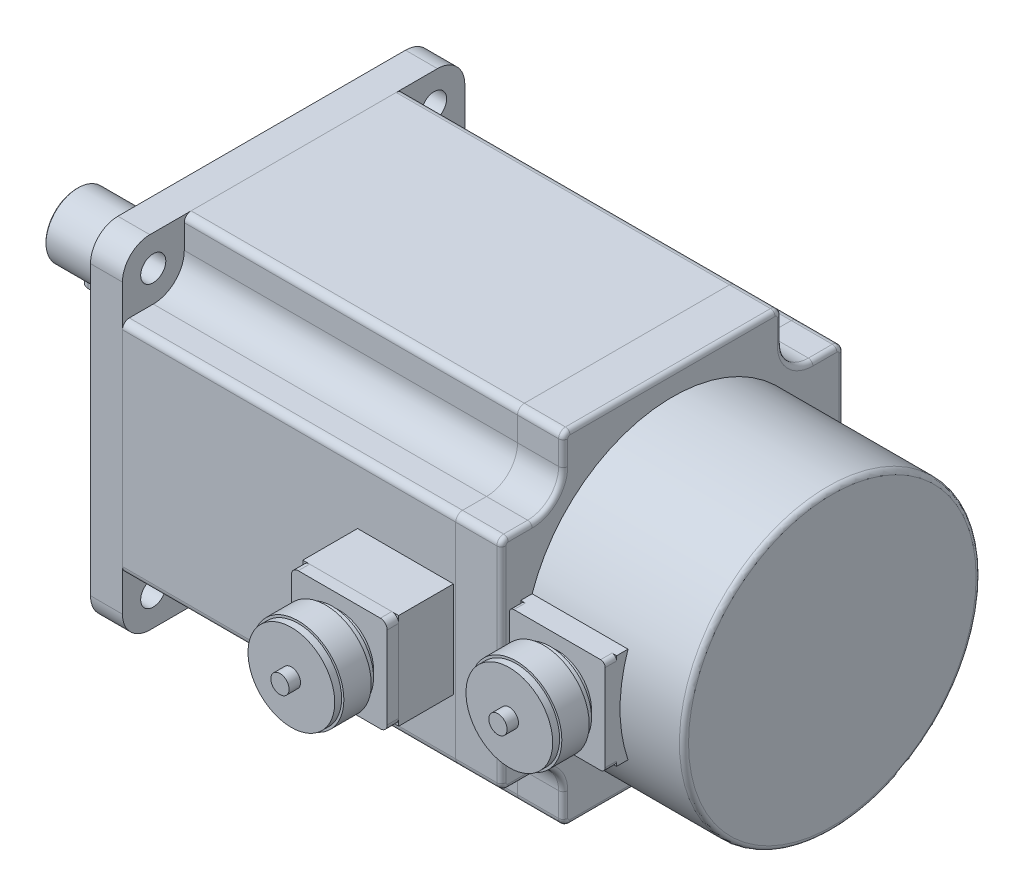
SolidWorks part; units mm, degrees
ref_plane "前视基准面" through (0, 0, 0) normal (0, 0, 1) x (1, 0, 0)
ref_plane "上视基准面" through (0, 0, 0) normal (0, 1, 0) x (1, 0, 0)
ref_plane "右视基准面" through (0, 0, 0) normal (1, 0, 0) x (0, 0, -1)
sketch "草图1" plane through (0, 0, 0) normal (1, 0, 0) x (0, 0, -1)
  line L1 (-63, -75) -> (63, -75)
  line L2 (-75, -63) -> (-75, 63)
  line L3 (-63, 75) -> (63, 75)
  line L4 (75, -63) -> (75, 63)
  line L5 (-75, -75) -> (75, 75) construction
  line L6 (-75, 75) -> (75, -75) construction
  arc A0 (63, -75) -> (75, -63) centre (63, -63) ccw
  arc A1 (-63, -75) -> (-75, -63) centre (-63, -63) cw
  arc A2 (-75, 63) -> (-63, 75) centre (-63, 63) cw
  arc A3 (63, 75) -> (75, 63) centre (63, 63) cw
  point P0 (0, 0)
  dimension "D1" = 12
extrude "凸台-拉伸1" add sketch "草图1" along normal blind 20
sketch "草图2" plane through (0, 0, 0) normal (-1, 0, 0) x (0, 0, 1)
  line L0 (-63, 75) -> (63, 75) construction
  line L1 (-63, -75) -> (63, -75)
  line L2 (-75, -63) -> (-75, 63)
  line L3 (-63, 75) -> (63, 75)
  line L4 (75, -63) -> (75, 63)
  line L5 (-75, -75) -> (75, 75) construction
  line L6 (-75, 75) -> (75, -75) construction
  arc A0 (63, 75) -> (75, 63) centre (63, 63) cw
  arc A1 (63, -75) -> (75, -63) centre (63, -63) ccw
  arc A2 (-63, -75) -> (-75, -63) centre (-63, -63) cw
  arc A3 (-75, 63) -> (-63, 75) centre (-63, 63) cw
  point P0 (0, 0)
  dimension "D1" = 12
extrude "凸台-拉伸2" add sketch "草图2" along normal blind 146 separate body
sketch "草图3" plane through (-146, 0, 0) normal (-1, 0, 0) x (0, 0, 1)
  line L0 (63, 75) -> (-63, 75) construction
  line L1 (-63, -75) -> (63, -75)
  line L2 (-75, -63) -> (-75, 63)
  line L3 (-63, 75) -> (63, 75)
  line L4 (75, -63) -> (75, 63)
  line L5 (-75, -75) -> (75, 75) construction
  line L6 (-75, 75) -> (75, -75) construction
  arc A0 (-63, -75) -> (-75, -63) centre (-63, -63) cw
  arc A1 (63, -75) -> (75, -63) centre (63, -63) ccw
  arc A2 (63, 75) -> (75, 63) centre (63, 63) cw
  arc A3 (-75, 63) -> (-63, 75) centre (-63, 63) cw
  point P0 (0, 0)
  dimension "D1" = 12
extrude "凸台-拉伸3" add sketch "草图3" along normal blind 14 separate body
sketch "草图4" plane through (0, 0, 75) normal (0, 0, 1) x (1, 0, 0)
  line L2 (-43, -21) -> (-1, -21)
  line L3 (-43, -21) -> (-43, 21)
  line L4 (-43, 21) -> (-1, 21)
  line L5 (-1, -21) -> (-1, 21)
  line L6 (-43, -21) -> (-1, 21) construction
  line L7 (-43, 21) -> (-1, -21) construction
extrude "凸台-拉伸4" add sketch "草图4" along normal blind 24 separate body
sketch "草图5" plane through (0, 0, 99) normal (0, 0, 1) x (1, 0, 0)
  line L0 (-1, 21) -> (-43, 21) construction
  line L1 (-40, -21) -> (-4, -21)
  line L2 (-43, -18) -> (-43, 18)
  line L3 (-40, 21) -> (-4, 21)
  line L4 (-1, -18) -> (-1, 18)
  line L5 (-43, -21) -> (-1, 21) construction
  line L6 (-43, 21) -> (-1, -21) construction
  arc A0 (-40, -21) -> (-43, -18) centre (-40, -18) cw
  arc A1 (-4, -21) -> (-1, -18) centre (-4, -18) ccw
  arc A2 (-4, 21) -> (-1, 18) centre (-4, 18) cw
  arc A3 (-43, 18) -> (-40, 21) centre (-40, 18) cw
  point P0 (-22, 0)
  dimension "D1" = 3
extrude "凸台-拉伸5" add sketch "草图5" along normal blind 5 separate body
sketch "草图6" plane through (0, 0, 104) normal (0, 0, 1) x (1, 0, 0)
  circle A0 centre (-22, 0) radius 15
extrude "凸台-拉伸6" add sketch "草图6" along normal blind 3 separate body
sketch "草图7" plane through (0, 0, 107) normal (0, 0, 1) x (1, 0, 0)
  circle A0 centre (-22, 0) radius 18
extrude "凸台-拉伸7" add sketch "草图7" along normal blind 3 separate body
sketch "草图8" plane through (0, 0, 110) normal (0, 0, 1) x (1, 0, 0)
  circle A0 centre (-22, 0) radius 20
extrude "凸台-拉伸8" add sketch "草图8" along normal blind 12 separate body
sketch "草图9" plane through (0, 0, 122) normal (0, 0, 1) x (1, 0, 0)
  circle A0 centre (-22, 0) radius 19
extrude "凸台-拉伸9" add sketch "草图9" along normal blind 3
sketch "草图10" plane through (0, 0, 125) normal (0, 0, 1) x (1, 0, 0)
  circle A0 centre (-22, 0) radius 4
extrude "凸台-拉伸10" add sketch "草图10" along normal blind 5
sketch "草图11" plane through (20, 0, 0) normal (1, 0, 0) x (0, 0, -1)
  line L0 (47.9169, -61.5) -> (47.9169, -72)
  line L1 (-75, -44.9169) -> (-75, -63)
  line L2 (-63, -75) -> (-44.9169, -75)
  line L3 (44.9169, -75) -> (63, -75)
  line L4 (75, -63) -> (75, -44.9169)
  line L6 (75, 63) -> (75, 44.9169)
  line L7 (-63, -75) -> (63, -75) construction
  line L8 (63, 75) -> (44.9169, 75)
  line L9 (-47.9169, -72) -> (-47.9169, -61.5)
  line L10 (-44.9169, 75) -> (-63, 75)
  line L11 (-61.5, -47.9169) -> (-72, -47.9169)
  line L12 (75, -63) -> (75, 63) construction
  line L13 (-75, 63) -> (-75, 44.9169)
  line L14 (-72, 47.9169) -> (-61.5, 47.9169)
  line L16 (-47.9169, 61.5) -> (-47.9169, 72)
  line L17 (63, 75) -> (-63, 75) construction
  line L19 (47.9169, 72) -> (47.9169, 61.5)
  line L21 (61.5, 47.9169) -> (72, 47.9169)
  line L22 (-75, 63) -> (-75, -63) construction
  line L24 (72, -47.9169) -> (61.5, -47.9169)
  arc A0 (-61.5, 47.9169) -> (-47.9169, 61.5) centre (-61.5, 61.5) ccw
  arc A1 (47.9169, 61.5) -> (61.5, 47.9169) centre (61.5, 61.5) ccw
  arc A2 (-47.9169, -61.5) -> (-61.5, -47.9169) centre (-61.5, -61.5) ccw
  arc A3 (-72, -47.9169) -> (-75, -44.9169) centre (-72, -44.9169) cw
  arc A4 (61.5, -47.9169) -> (47.9169, -61.5) centre (61.5, -61.5) ccw
  arc A5 (-75, 44.9169) -> (-72, 47.9169) centre (-72, 44.9169) cw
  arc A6 (-47.9169, 72) -> (-44.9169, 75) centre (-44.9169, 72) cw
  arc A7 (44.9169, 75) -> (47.9169, 72) centre (44.9169, 72) cw
  arc A8 (72, 47.9169) -> (75, 44.9169) centre (72, 44.9169) cw
  arc A9 (75, -44.9169) -> (72, -47.9169) centre (72, -44.9169) cw
  arc A10 (47.9169, -72) -> (44.9169, -75) centre (44.9169, -72) cw
  arc A11 (-44.9169, -75) -> (-47.9169, -72) centre (-44.9169, -72) cw
  arc A12 (-63, 75) -> (-75, 63) centre (-63, 63) ccw
  arc A13 (75, 63) -> (63, 75) centre (63, 63) ccw
  arc A14 (63, -75) -> (75, -63) centre (63, -63) ccw
  arc A15 (-75, -63) -> (-63, -75) centre (-63, -63) ccw
  point P0 (0, 0)
  point P1 (0, 0)
  point P12 (-75, -47.9169)
  point P43 (-75, 47.9169)
  point P47 (-47.9169, 75)
  point P48 (51.9891, -75)
  point P52 (47.9169, 75)
  point P56 (75, 47.9169)
  point P65 (75, -47.9169)
  point P82 (-47.9169, -75)
  dimension "D1" = 3
extrude "切除-拉伸2" cut sketch "草图11" against normal blind 166
fillet "圆角1" radius 2 24 edges at (20, 75, 0) (20, 0, -75) (20, -75, 0) (20, 0, 75) (20, 47.0382, 74.1213) (20, 47.9169, 66.75) (20, 51.8953, 51.8953) (20, 66.75, 47.9169) (20, 74.1213, 47.0382) (20, 74.1213, -47.0382) (20, 66.75, -47.9169) (20, 51.8953, -51.8953) (20, 47.9169, -66.75) (20, 47.0382, -74.1213) (20, -47.0382, -74.1213) (20, -47.9169, -66.75) (20, -51.8953, -51.8953) (20, -66.75, -47.9169) (20, -74.1213, -47.0382) (20, -74.1213, 47.0382) (20, -66.75, 47.9169) (20, -51.8953, 51.8953) (20, -47.9169, 66.75) (20, -47.0382, 74.1213)
sketch "草图12" plane through (-160, 0, 0) normal (-1, 0, 0) x (0, 0, 1)
  circle A2 centre (-61.5183, 61.5183) radius 5.5
  circle A3 centre (61.5183, 61.5183) radius 5.5
  circle A4 centre (-61.5183, -61.5183) radius 5.5
  circle A5 centre (61.5183, -61.5183) radius 5.5
extrude "切除-拉伸3" cut sketch "草图12" against normal blind 14
sketch "草图13" plane through (-160, 0, 0) normal (-1, 0, 0) x (0, 0, 1)
  circle A0 centre (0, 0) radius 65
  circle A1 centre (0, 0) radius 57.5
extrude "凸台-拉伸11" add sketch "草图13" along normal blind 6 separate body
sketch "草图14" plane through (-160, 0, 0) normal (-1, 0, 0) x (0, 0, 1)
  circle A0 centre (0, 0) radius 35
extrude "凸台-拉伸12" add sketch "草图14" along normal blind 6
sketch "草图15" plane through (-166, 0, 0) normal (-1, 0, 0) x (0, 0, 1)
  circle A0 centre (0, 0) radius 17.5
extrude "凸台-拉伸13" add sketch "草图15" along normal blind 3 separate body
fillet "圆角2" radius 0.5 1 edges at (-169, 0, 17.5)
sketch "草图16" plane through (-169, 0, 0) normal (-1, 0, 0) x (0, 0, 1)
  circle A0 centre (0, 0) radius 14
extrude "凸台-拉伸14" add sketch "草图16" along normal blind 72
chamfer "倒角1" distance 0.5 angle 45 1 edges at (-241, 0, 14)
ref_plane "基准面1" through (0, -14, 0) normal (0, 1, 0) x (1, 0, 0)
sketch "草图19" plane through (20, 0, 0) normal (1, 0, 0) x (0, 0, -1)
  circle A0 centre (0, 0) radius 65
extrude "凸台-拉伸16" add sketch "草图19" along normal blind 70 separate body
fillet "圆角3" radius 2 1 edges at (90, 0, -65)
ref_plane "基准面2" through (0, 0, 65) normal (0, 0, 1) x (1, 0, 0)
sketch "草图20" plane through (0, 0, 65) normal (0, 0, 1) x (1, 0, 0)
  line L1 (20, 65) -> (20, -65) construction
  line L3 (62, -21) -> (20, -21)
  line L4 (62, -21) -> (62, 21)
  line L5 (62, 21) -> (20, 21)
  line L6 (20, -21) -> (20, 21)
  line L7 (62, -21) -> (20, 21) construction
  line L8 (62, 21) -> (20, -21) construction
extrude "切除-拉伸5" cut sketch "草图20" against normal blind 10
sketch "草图21" plane through (0, 0, 55) normal (0, 0, 1) x (1, 0, 0)
  line L0 (62, 21) -> (20, 21) construction
  line L1 (20, -21) -> (62, -21)
  line L2 (20, -21) -> (20, 21)
  line L3 (20, 21) -> (62, 21)
  line L4 (62, -21) -> (62, 21)
  line L5 (20, -21) -> (62, 21) construction
  line L6 (20, 21) -> (62, -21) construction
  line L7 (20, 21) -> (62, 21) construction
  point P0 (41, 0)
extrude "凸台-拉伸17" add sketch "草图21" along normal blind 11.5
sketch "草图22" plane through (0, 0, 66.5) normal (0, 0, 1) x (1, 0, 0)
  line L0 (62, -21) -> (62, 21) construction
  line L1 (22, -21) -> (60, -21)
  line L2 (20, -19) -> (20, 19)
  line L3 (22, 21) -> (60, 21)
  line L4 (62, -19) -> (62, 19)
  line L5 (20, -21) -> (62, 21) construction
  line L6 (20, 21) -> (62, -21) construction
  line L7 (20, 21) -> (62, 21) construction
  arc A0 (22, -21) -> (20, -19) centre (22, -19) cw
  arc A1 (60, -21) -> (62, -19) centre (60, -19) ccw
  arc A2 (60, 21) -> (62, 19) centre (60, 19) cw
  arc A3 (20, 19) -> (22, 21) centre (22, 19) cw
  point P0 (41, 0)
  dimension "D1" = 2
extrude "凸台-拉伸18" add sketch "草图22" along normal blind 5 separate body
sketch "草图23" plane through (0, 0, 71.5) normal (0, 0, 1) x (1, 0, 0)
  circle A0 centre (41, 0) radius 15
extrude "凸台-拉伸19" add sketch "草图23" along normal blind 3
sketch "草图24" plane through (0, 0, 74.5) normal (0, 0, 1) x (1, 0, 0)
  circle A0 centre (41, 0) radius 18
extrude "凸台-拉伸20" add sketch "草图24" along normal blind 3
sketch "草图25" plane through (0, 0, 77.5) normal (0, 0, 1) x (1, 0, 0)
  circle A0 centre (41, 0) radius 20
extrude "凸台-拉伸21" add sketch "草图25" along normal blind 12
sketch "草图26" plane through (0, 0, 89.5) normal (0, 0, 1) x (1, 0, 0)
  circle A0 centre (41, 0) radius 19
extrude "凸台-拉伸22" add sketch "草图26" along normal blind 3
sketch "草图27" plane through (0, 0, 92.5) normal (0, 0, 1) x (1, 0, 0)
  circle A0 centre (41, 0) radius 4
extrude "凸台-拉伸23" add sketch "草图27" along normal blind 5
sketch "草图29" plane through (0, -14, 0) normal (0, 1, 0) x (1, 0, 0)
  line L4 (-232, -4) -> (-185, -4)
  line L6 (-185, 4) -> (-232, 4)
  arc A0 (-232, 4) -> (-232, -4) centre (-232, 0) ccw
  arc A1 (-185, -4) -> (-185, 4) centre (-185, 0) ccw
extrude "切除-拉伸6" cut sketch "草图29" along normal blind 4
sketch "草图30" plane through (0, -10, 0) normal (0, -1, 0) x (1, 0, 0)
  line L0 (-232, 4) -> (-185, 4)
  line L2 (-185, -4) -> (-232, -4)
  arc A0 (-232, 4) -> (-232, -4) centre (-232, 0) ccw
  arc A1 (-185, -4) -> (-185, 4) centre (-185, 0) ccw
extrude "凸台-拉伸24" add sketch "草图30" along normal blind 8 separate body
